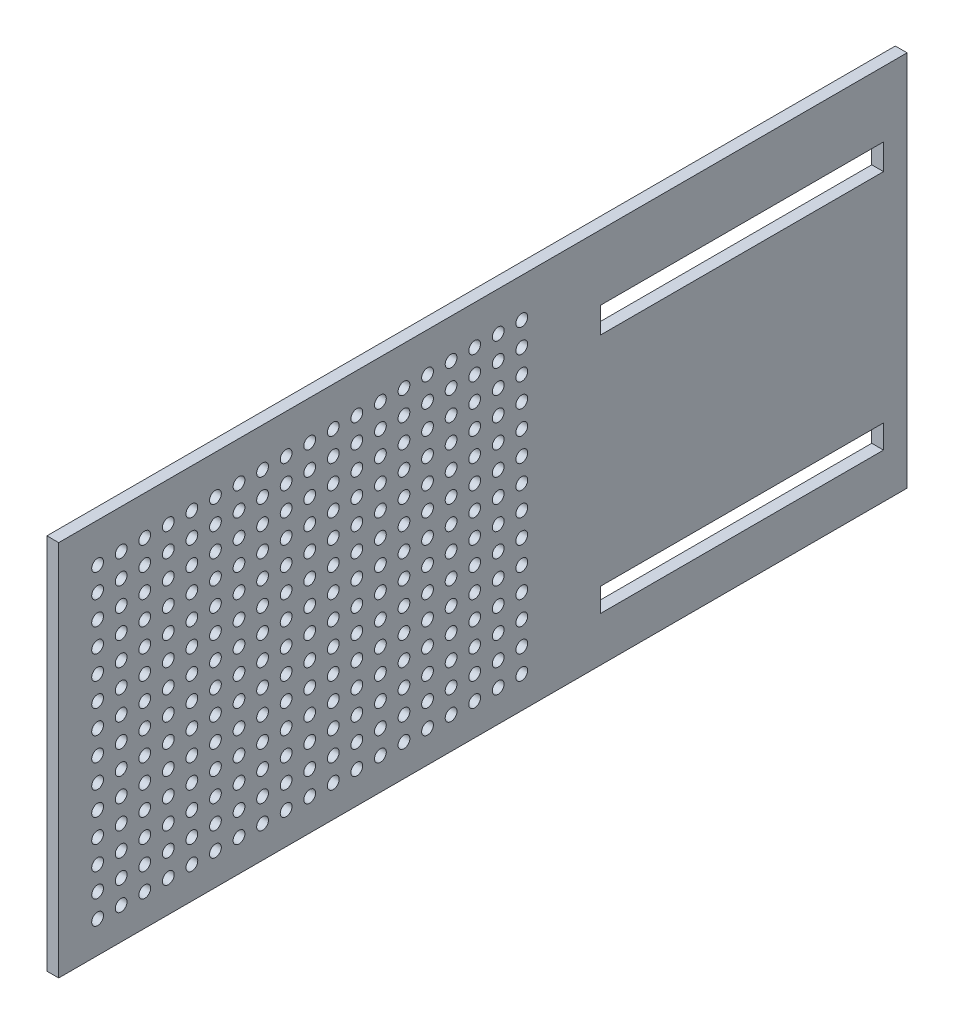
SolidWorks part; units mm, degrees
ref_plane "Front Plane" through (0, 0, 0) normal (0, 0, 1) x (1, 0, 0)
ref_plane "Top Plane" through (0, 0, 0) normal (0, 1, 0) x (1, 0, 0)
ref_plane "Right Plane" through (0, 0, 0) normal (1, 0, 0) x (0, 0, -1)
sketch "Sketch1" plane through (0, 0, 0) normal (0, 0, 1) x (1, 0, 0)
  line L0 (1.5875, 47.625) -> (36.5125, 47.625)
  line L1 (1.5875, -50.8) -> (-1.5875, -50.8)
  line L2 (1.5875, -50.8) -> (1.5875, 47.625)
  line L4 (-1.5875, -50.8) -> (-1.5875, 50.8)
  line L5 (1.5875, -50.8) -> (-1.5875, 50.8) construction
  line L6 (3.5127, 112.4075) -> (-1.5875, -50.8) construction
  line L7 (-1.5875, 50.8) -> (36.5125, 50.8)
  line L10 (36.5125, 50.8) -> (36.5125, 47.625)
  point P0 (0, 0)
  point P7 (0, -50.8)
extrude "Boss-Extrude1" add sketch "Sketch1" along normal blind 228.6
sketch "Sketch2" plane through (1.5875, 0, 0) normal (1, 0, 0) x (0, 0, -1)
  line L0 (-228.6, -29.4596) -> (0, 47.625) construction
  line L1 (-228.6, -50.8) -> (-228.6, 47.625) construction
  line L2 (-228.6, 47.625) -> (0, 47.625) construction
  line L3 (0, -50.8) -> (0, 47.625) construction
ref_plane "Plane1 - BACKBOARD PLANE" through (0, 42.7626, 14.4197) normal (0, -0.9476, -0.3195) x (0, 0.3195, -0.9476)
ref_plane "Plane1" through (0, -1.5875, 0) normal (0, -1, 0) x (-1, 0, 0)
sketch "Sketch3" plane through (-1.5875, 0, 0) normal (-1, 0, 0) x (0, 0, 1)
  line L0 (228.6, -50.8) -> (0, -50.8) construction
  line L1 (82.55, -32.385) -> (6.35, -32.385)
  line L2 (82.55, -32.385) -> (82.55, -38.735)
  line L3 (82.55, -38.735) -> (6.35, -38.735)
  line L4 (6.35, -32.385) -> (6.35, -38.735)
  line L5 (82.55, -32.385) -> (6.35, -38.735) construction
  line L6 (82.55, -38.735) -> (6.35, -32.385) construction
  line L7 (0, 50.8) -> (0, -50.8) construction
  line L18 (6.35, 33.1888) -> (82.55, 33.1888)
  line L19 (6.35, 33.1888) -> (6.35, 26.2472)
  line L20 (6.35, 26.2472) -> (82.55, 26.2472)
  line L21 (82.55, 33.1888) -> (82.55, 26.2472)
  point P0 (44.45, -35.56)
  point P13 (6.35, 29.718)
  point P14 (6.35, -35.56)
  dimension "D1" = 6.35
  dimension "D2" = 15.24
  dimension "D3" = 76.2
  dimension "D4" = 6.35
  dimension "D5" = 65.278
extrude "Cut-Extrude1" cut sketch "Sketch3" against normal up to next
sketch "Sketch4" plane through (-1.5875, 0, 0) normal (-1, 0, 0) x (0, 0, 1)
  circle A0 centre (103.8185, 40.3289) radius 1.5875
  circle A1 centre (110.1685, 40.3289) radius 1.5875
  circle A2 centre (116.5185, 40.3289) radius 1.5875
  circle A3 centre (122.8685, 40.3289) radius 1.5875
  circle A4 centre (129.2185, 40.3289) radius 1.5875
  circle A5 centre (110.1685, 33.9789) radius 1.5875
  circle A6 centre (116.5185, 33.9789) radius 1.5875
  circle A7 centre (122.8685, 33.9789) radius 1.5875
  circle A8 centre (129.2185, 33.9789) radius 1.5875
  circle A9 centre (110.1685, 27.6289) radius 1.5875
  circle A10 centre (116.5185, 27.6289) radius 1.5875
  circle A11 centre (122.8685, 27.6289) radius 1.5875
  circle A12 centre (129.2185, 27.6289) radius 1.5875
  circle A13 centre (110.1685, 21.2789) radius 1.5875
  circle A14 centre (116.5185, 21.2789) radius 1.5875
  circle A15 centre (122.8685, 21.2789) radius 1.5875
  circle A16 centre (129.2185, 21.2789) radius 1.5875
  circle A17 centre (103.8185, 33.9789) radius 1.5875
  circle A18 centre (103.8185, 27.6289) radius 1.5875
  circle A19 centre (103.8185, 21.2789) radius 1.5875
  circle A20 centre (135.5685, 40.3289) radius 1.5875
  circle A21 centre (141.9185, 40.3289) radius 1.5875
  circle A22 centre (148.2685, 40.3289) radius 1.5875
  circle A23 centre (154.6185, 40.3289) radius 1.5875
  circle A24 centre (160.9685, 40.3289) radius 1.5875
  circle A25 centre (167.3185, 40.3289) radius 1.5875
  circle A26 centre (173.6685, 40.3289) radius 1.5875
  circle A27 centre (180.0185, 40.3289) radius 1.5875
  circle A28 centre (186.3685, 40.3289) radius 1.5875
  circle A29 centre (192.7185, 40.3289) radius 1.5875
  circle A30 centre (199.0685, 40.3289) radius 1.5875
  circle A31 centre (205.4185, 40.3289) radius 1.5875
  circle A32 centre (211.7685, 40.3289) radius 1.5875
  circle A33 centre (218.1185, 40.3289) radius 1.5875
  circle A34 centre (135.5685, 33.9789) radius 1.5875
  circle A35 centre (141.9185, 33.9789) radius 1.5875
  circle A36 centre (148.2685, 33.9789) radius 1.5875
  circle A37 centre (154.6185, 33.9789) radius 1.5875
  circle A38 centre (160.9685, 33.9789) radius 1.5875
  circle A39 centre (167.3185, 33.9789) radius 1.5875
  circle A40 centre (173.6685, 33.9789) radius 1.5875
  circle A41 centre (180.0185, 33.9789) radius 1.5875
  circle A42 centre (186.3685, 33.9789) radius 1.5875
  circle A43 centre (192.7185, 33.9789) radius 1.5875
  circle A44 centre (199.0685, 33.9789) radius 1.5875
  circle A45 centre (205.4185, 33.9789) radius 1.5875
  circle A46 centre (211.7685, 33.9789) radius 1.5875
  circle A47 centre (218.1185, 33.9789) radius 1.5875
  circle A48 centre (135.5685, 27.6289) radius 1.5875
  circle A49 centre (141.9185, 27.6289) radius 1.5875
  circle A50 centre (148.2685, 27.6289) radius 1.5875
  circle A51 centre (154.6185, 27.6289) radius 1.5875
  circle A52 centre (160.9685, 27.6289) radius 1.5875
  circle A53 centre (167.3185, 27.6289) radius 1.5875
  circle A54 centre (173.6685, 27.6289) radius 1.5875
  circle A55 centre (180.0185, 27.6289) radius 1.5875
  circle A56 centre (186.3685, 27.6289) radius 1.5875
  circle A57 centre (192.7185, 27.6289) radius 1.5875
  circle A58 centre (199.0685, 27.6289) radius 1.5875
  circle A59 centre (205.4185, 27.6289) radius 1.5875
  circle A60 centre (211.7685, 27.6289) radius 1.5875
  circle A61 centre (218.1185, 27.6289) radius 1.5875
  circle A62 centre (135.5685, 21.2789) radius 1.5875
  circle A63 centre (141.9185, 21.2789) radius 1.5875
  circle A64 centre (148.2685, 21.2789) radius 1.5875
  circle A65 centre (154.6185, 21.2789) radius 1.5875
  circle A66 centre (160.9685, 21.2789) radius 1.5875
  circle A67 centre (167.3185, 21.2789) radius 1.5875
  circle A68 centre (173.6685, 21.2789) radius 1.5875
  circle A69 centre (180.0185, 21.2789) radius 1.5875
  circle A70 centre (186.3685, 21.2789) radius 1.5875
  circle A71 centre (192.7185, 21.2789) radius 1.5875
  circle A72 centre (199.0685, 21.2789) radius 1.5875
  circle A73 centre (205.4185, 21.2789) radius 1.5875
  circle A74 centre (211.7685, 21.2789) radius 1.5875
  circle A75 centre (218.1185, 21.2789) radius 1.5875
  circle A76 centre (103.8185, 14.9289) radius 1.5875
  circle A77 centre (110.1685, 14.9289) radius 1.5875
  circle A78 centre (116.5185, 14.9289) radius 1.5875
  circle A79 centre (122.8685, 14.9289) radius 1.5875
  circle A80 centre (129.2185, 14.9289) radius 1.5875
  circle A81 centre (135.5685, 14.9289) radius 1.5875
  circle A82 centre (141.9185, 14.9289) radius 1.5875
  circle A83 centre (148.2685, 14.9289) radius 1.5875
  circle A84 centre (154.6185, 14.9289) radius 1.5875
  circle A85 centre (160.9685, 14.9289) radius 1.5875
  circle A86 centre (167.3185, 14.9289) radius 1.5875
  circle A87 centre (173.6685, 14.9289) radius 1.5875
  circle A88 centre (180.0185, 14.9289) radius 1.5875
  circle A89 centre (186.3685, 14.9289) radius 1.5875
  circle A90 centre (192.7185, 14.9289) radius 1.5875
  circle A91 centre (199.0685, 14.9289) radius 1.5875
  circle A92 centre (205.4185, 14.9289) radius 1.5875
  circle A93 centre (211.7685, 14.9289) radius 1.5875
  circle A94 centre (218.1185, 14.9289) radius 1.5875
  circle A95 centre (103.8185, 8.5789) radius 1.5875
  circle A96 centre (110.1685, 8.5789) radius 1.5875
  circle A97 centre (116.5185, 8.5789) radius 1.5875
  circle A98 centre (122.8685, 8.5789) radius 1.5875
  circle A99 centre (129.2185, 8.5789) radius 1.5875
  circle A100 centre (135.5685, 8.5789) radius 1.5875
  circle A101 centre (141.9185, 8.5789) radius 1.5875
  circle A102 centre (148.2685, 8.5789) radius 1.5875
  circle A103 centre (154.6185, 8.5789) radius 1.5875
  circle A104 centre (160.9685, 8.5789) radius 1.5875
  circle A105 centre (167.3185, 8.5789) radius 1.5875
  circle A106 centre (173.6685, 8.5789) radius 1.5875
  circle A107 centre (180.0185, 8.5789) radius 1.5875
  circle A108 centre (186.3685, 8.5789) radius 1.5875
  circle A109 centre (192.7185, 8.5789) radius 1.5875
  circle A110 centre (199.0685, 8.5789) radius 1.5875
  circle A111 centre (205.4185, 8.5789) radius 1.5875
  circle A112 centre (211.7685, 8.5789) radius 1.5875
  circle A113 centre (218.1185, 8.5789) radius 1.5875
  circle A114 centre (103.8185, 2.2289) radius 1.5875
  circle A115 centre (110.1685, 2.2289) radius 1.5875
  circle A116 centre (116.5185, 2.2289) radius 1.5875
  circle A117 centre (122.8685, 2.2289) radius 1.5875
  circle A118 centre (129.2185, 2.2289) radius 1.5875
  circle A119 centre (135.5685, 2.2289) radius 1.5875
  circle A120 centre (141.9185, 2.2289) radius 1.5875
  circle A121 centre (148.2685, 2.2289) radius 1.5875
  circle A122 centre (154.6185, 2.2289) radius 1.5875
  circle A123 centre (160.9685, 2.2289) radius 1.5875
  circle A124 centre (167.3185, 2.2289) radius 1.5875
  circle A125 centre (173.6685, 2.2289) radius 1.5875
  circle A126 centre (180.0185, 2.2289) radius 1.5875
  circle A127 centre (186.3685, 2.2289) radius 1.5875
  circle A128 centre (192.7185, 2.2289) radius 1.5875
  circle A129 centre (199.0685, 2.2289) radius 1.5875
  circle A130 centre (205.4185, 2.2289) radius 1.5875
  circle A131 centre (211.7685, 2.2289) radius 1.5875
  circle A132 centre (218.1185, 2.2289) radius 1.5875
  circle A133 centre (103.8185, -4.1211) radius 1.5875
  circle A134 centre (110.1685, -4.1211) radius 1.5875
  circle A135 centre (116.5185, -4.1211) radius 1.5875
  circle A136 centre (122.8685, -4.1211) radius 1.5875
  circle A137 centre (129.2185, -4.1211) radius 1.5875
  circle A138 centre (135.5685, -4.1211) radius 1.5875
  circle A139 centre (141.9185, -4.1211) radius 1.5875
  circle A140 centre (148.2685, -4.1211) radius 1.5875
  circle A141 centre (154.6185, -4.1211) radius 1.5875
  circle A142 centre (160.9685, -4.1211) radius 1.5875
  circle A143 centre (167.3185, -4.1211) radius 1.5875
  circle A144 centre (173.6685, -4.1211) radius 1.5875
  circle A145 centre (180.0185, -4.1211) radius 1.5875
  circle A146 centre (186.3685, -4.1211) radius 1.5875
  circle A147 centre (192.7185, -4.1211) radius 1.5875
  circle A148 centre (199.0685, -4.1211) radius 1.5875
  circle A149 centre (205.4185, -4.1211) radius 1.5875
  circle A150 centre (211.7685, -4.1211) radius 1.5875
  circle A151 centre (218.1185, -4.1211) radius 1.5875
  circle A152 centre (103.8185, -10.4711) radius 1.5875
  circle A153 centre (110.1685, -10.4711) radius 1.5875
  circle A154 centre (116.5185, -10.4711) radius 1.5875
  circle A155 centre (122.8685, -10.4711) radius 1.5875
  circle A156 centre (129.2185, -10.4711) radius 1.5875
  circle A157 centre (135.5685, -10.4711) radius 1.5875
  circle A158 centre (141.9185, -10.4711) radius 1.5875
  circle A159 centre (148.2685, -10.4711) radius 1.5875
  circle A160 centre (154.6185, -10.4711) radius 1.5875
  circle A161 centre (160.9685, -10.4711) radius 1.5875
  circle A162 centre (167.3185, -10.4711) radius 1.5875
  circle A163 centre (173.6685, -10.4711) radius 1.5875
  circle A164 centre (180.0185, -10.4711) radius 1.5875
  circle A165 centre (186.3685, -10.4711) radius 1.5875
  circle A166 centre (192.7185, -10.4711) radius 1.5875
  circle A167 centre (199.0685, -10.4711) radius 1.5875
  circle A168 centre (205.4185, -10.4711) radius 1.5875
  circle A169 centre (211.7685, -10.4711) radius 1.5875
  circle A170 centre (218.1185, -10.4711) radius 1.5875
  circle A171 centre (103.8185, -16.8211) radius 1.5875
  circle A172 centre (110.1685, -16.8211) radius 1.5875
  circle A173 centre (116.5185, -16.8211) radius 1.5875
  circle A174 centre (122.8685, -16.8211) radius 1.5875
  circle A175 centre (129.2185, -16.8211) radius 1.5875
  circle A176 centre (135.5685, -16.8211) radius 1.5875
  circle A177 centre (141.9185, -16.8211) radius 1.5875
  circle A178 centre (148.2685, -16.8211) radius 1.5875
  circle A179 centre (154.6185, -16.8211) radius 1.5875
  circle A180 centre (160.9685, -16.8211) radius 1.5875
  circle A181 centre (167.3185, -16.8211) radius 1.5875
  circle A182 centre (173.6685, -16.8211) radius 1.5875
  circle A183 centre (180.0185, -16.8211) radius 1.5875
  circle A184 centre (186.3685, -16.8211) radius 1.5875
  circle A185 centre (192.7185, -16.8211) radius 1.5875
  circle A186 centre (199.0685, -16.8211) radius 1.5875
  circle A187 centre (205.4185, -16.8211) radius 1.5875
  circle A188 centre (211.7685, -16.8211) radius 1.5875
  circle A189 centre (218.1185, -16.8211) radius 1.5875
  circle A190 centre (103.8185, -23.1711) radius 1.5875
  circle A191 centre (110.1685, -23.1711) radius 1.5875
  circle A192 centre (116.5185, -23.1711) radius 1.5875
  circle A193 centre (122.8685, -23.1711) radius 1.5875
  circle A194 centre (129.2185, -23.1711) radius 1.5875
  circle A195 centre (135.5685, -23.1711) radius 1.5875
  circle A196 centre (141.9185, -23.1711) radius 1.5875
  circle A197 centre (148.2685, -23.1711) radius 1.5875
  circle A198 centre (154.6185, -23.1711) radius 1.5875
  circle A199 centre (160.9685, -23.1711) radius 1.5875
  circle A200 centre (167.3185, -23.1711) radius 1.5875
  circle A201 centre (173.6685, -23.1711) radius 1.5875
  circle A202 centre (180.0185, -23.1711) radius 1.5875
  circle A203 centre (186.3685, -23.1711) radius 1.5875
  circle A204 centre (192.7185, -23.1711) radius 1.5875
  circle A205 centre (199.0685, -23.1711) radius 1.5875
  circle A206 centre (205.4185, -23.1711) radius 1.5875
  circle A207 centre (211.7685, -23.1711) radius 1.5875
  circle A208 centre (218.1185, -23.1711) radius 1.5875
  circle A209 centre (103.8185, -29.5211) radius 1.5875
  circle A210 centre (110.1685, -29.5211) radius 1.5875
  circle A211 centre (116.5185, -29.5211) radius 1.5875
  circle A212 centre (122.8685, -29.5211) radius 1.5875
  circle A213 centre (129.2185, -29.5211) radius 1.5875
  circle A214 centre (135.5685, -29.5211) radius 1.5875
  circle A215 centre (141.9185, -29.5211) radius 1.5875
  circle A216 centre (148.2685, -29.5211) radius 1.5875
  circle A217 centre (154.6185, -29.5211) radius 1.5875
  circle A218 centre (160.9685, -29.5211) radius 1.5875
  circle A219 centre (167.3185, -29.5211) radius 1.5875
  circle A220 centre (173.6685, -29.5211) radius 1.5875
  circle A221 centre (180.0185, -29.5211) radius 1.5875
  circle A222 centre (186.3685, -29.5211) radius 1.5875
  circle A223 centre (192.7185, -29.5211) radius 1.5875
  circle A224 centre (199.0685, -29.5211) radius 1.5875
  circle A225 centre (205.4185, -29.5211) radius 1.5875
  circle A226 centre (211.7685, -29.5211) radius 1.5875
  circle A227 centre (218.1185, -29.5211) radius 1.5875
  circle A228 centre (103.8185, -35.8711) radius 1.5875
  circle A229 centre (110.1685, -35.8711) radius 1.5875
  circle A230 centre (116.5185, -35.8711) radius 1.5875
  circle A231 centre (122.8685, -35.8711) radius 1.5875
  circle A232 centre (129.2185, -35.8711) radius 1.5875
  circle A233 centre (135.5685, -35.8711) radius 1.5875
  circle A234 centre (141.9185, -35.8711) radius 1.5875
  circle A235 centre (148.2685, -35.8711) radius 1.5875
  circle A236 centre (154.6185, -35.8711) radius 1.5875
  circle A237 centre (160.9685, -35.8711) radius 1.5875
  circle A238 centre (167.3185, -35.8711) radius 1.5875
  circle A239 centre (173.6685, -35.8711) radius 1.5875
  circle A240 centre (180.0185, -35.8711) radius 1.5875
  circle A241 centre (186.3685, -35.8711) radius 1.5875
  circle A242 centre (192.7185, -35.8711) radius 1.5875
  circle A243 centre (199.0685, -35.8711) radius 1.5875
  circle A244 centre (205.4185, -35.8711) radius 1.5875
  circle A245 centre (211.7685, -35.8711) radius 1.5875
  circle A246 centre (218.1185, -35.8711) radius 1.5875
  circle A247 centre (103.8185, -42.2211) radius 1.5875
  circle A248 centre (110.1685, -42.2211) radius 1.5875
  circle A249 centre (116.5185, -42.2211) radius 1.5875
  circle A250 centre (122.8685, -42.2211) radius 1.5875
  circle A251 centre (129.2185, -42.2211) radius 1.5875
  circle A252 centre (135.5685, -42.2211) radius 1.5875
  circle A253 centre (141.9185, -42.2211) radius 1.5875
  circle A254 centre (148.2685, -42.2211) radius 1.5875
  circle A255 centre (154.6185, -42.2211) radius 1.5875
  circle A256 centre (160.9685, -42.2211) radius 1.5875
  circle A257 centre (167.3185, -42.2211) radius 1.5875
  circle A258 centre (173.6685, -42.2211) radius 1.5875
  circle A259 centre (180.0185, -42.2211) radius 1.5875
  circle A260 centre (186.3685, -42.2211) radius 1.5875
  circle A261 centre (192.7185, -42.2211) radius 1.5875
  circle A262 centre (199.0685, -42.2211) radius 1.5875
  circle A263 centre (205.4185, -42.2211) radius 1.5875
  circle A264 centre (211.7685, -42.2211) radius 1.5875
  circle A265 centre (218.1185, -42.2211) radius 1.5875
  dimension "D1" = 3.175
  dimension "D2" = 19
  dimension "D3" = 14
extrude "Cut-Extrude2" cut sketch "Sketch4" against normal up to next (3.175 mm away)
sketch "Sketch5" plane through (0, 50.8, 0) normal (0, 1, 0) x (1, 0, 0)
  line L0 (36.5125, 0) -> (-1.5875, 0) construction
  line L1 (18.7325, -5.08) -> (12.1285, -5.08)
  line L2 (18.7325, -5.08) -> (18.7325, -157.48)
  line L3 (18.7325, -157.48) -> (12.1285, -157.48)
  line L4 (12.1285, -5.08) -> (12.1285, -157.48)
  line L5 (36.5125, -228.6) -> (36.5125, 0) construction
  point P8 (15.4305, -5.08)
  dimension "D1" = 6.604
  dimension "D2" = 152.4
  dimension "D3" = 5.08
  dimension "D4" = 21.082
extrude "Cut-Extrude3" cut sketch "Sketch5" against normal up to next
sketch "Sketch6" plane through (0, 50.8, 0) normal (0, 1, 0) x (1, 0, 0)
  line L0 (36.5125, -228.6) -> (-1.5875, -228.6) construction
  line L1 (36.5125, -228.6) -> (36.5125, 0) construction
  circle A0 centre (6.0325, -222.25) radius 1.5875
  circle A1 centre (12.3825, -222.25) radius 1.5875
  circle A2 centre (18.7325, -222.25) radius 1.5875
  circle A3 centre (25.0825, -222.25) radius 1.5875
  circle A4 centre (31.4325, -222.25) radius 1.5875
  circle A5 centre (12.3825, -215.9) radius 1.5875
  circle A6 centre (18.7325, -215.9) radius 1.5875
  circle A7 centre (25.0825, -215.9) radius 1.5875
  circle A8 centre (31.4325, -215.9) radius 1.5875
  circle A9 centre (12.3825, -209.55) radius 1.5875
  circle A10 centre (18.7325, -209.55) radius 1.5875
  circle A11 centre (25.0825, -209.55) radius 1.5875
  circle A12 centre (31.4325, -209.55) radius 1.5875
  circle A13 centre (12.3825, -203.2) radius 1.5875
  circle A14 centre (18.7325, -203.2) radius 1.5875
  circle A15 centre (25.0825, -203.2) radius 1.5875
  circle A16 centre (31.4325, -203.2) radius 1.5875
  circle A17 centre (12.3825, -196.85) radius 1.5875
  circle A18 centre (18.7325, -196.85) radius 1.5875
  circle A19 centre (25.0825, -196.85) radius 1.5875
  circle A20 centre (31.4325, -196.85) radius 1.5875
  circle A21 centre (12.3825, -190.5) radius 1.5875
  circle A22 centre (18.7325, -190.5) radius 1.5875
  circle A23 centre (25.0825, -190.5) radius 1.5875
  circle A24 centre (31.4325, -190.5) radius 1.5875
  circle A25 centre (12.3825, -184.15) radius 1.5875
  circle A26 centre (18.7325, -184.15) radius 1.5875
  circle A27 centre (25.0825, -184.15) radius 1.5875
  circle A28 centre (31.4325, -184.15) radius 1.5875
  circle A29 centre (12.3825, -177.8) radius 1.5875
  circle A30 centre (18.7325, -177.8) radius 1.5875
  circle A31 centre (25.0825, -177.8) radius 1.5875
  circle A32 centre (31.4325, -177.8) radius 1.5875
  circle A33 centre (12.3825, -171.45) radius 1.5875
  circle A34 centre (18.7325, -171.45) radius 1.5875
  circle A35 centre (25.0825, -171.45) radius 1.5875
  circle A36 centre (31.4325, -171.45) radius 1.5875
  circle A37 centre (12.3825, -165.1) radius 1.5875
  circle A38 centre (18.7325, -165.1) radius 1.5875
  circle A39 centre (25.0825, -165.1) radius 1.5875
  circle A40 centre (31.4325, -165.1) radius 1.5875
  circle A43 centre (25.0825, -158.75) radius 1.5875
  circle A44 centre (31.4325, -158.75) radius 1.5875
  circle A47 centre (25.0825, -152.4) radius 1.5875
  circle A48 centre (31.4325, -152.4) radius 1.5875
  circle A51 centre (25.0825, -146.05) radius 1.5875
  circle A52 centre (31.4325, -146.05) radius 1.5875
  circle A55 centre (25.0825, -139.7) radius 1.5875
  circle A56 centre (31.4325, -139.7) radius 1.5875
  circle A59 centre (25.0825, -133.35) radius 1.5875
  circle A60 centre (31.4325, -133.35) radius 1.5875
  circle A63 centre (25.0825, -127) radius 1.5875
  circle A64 centre (31.4325, -127) radius 1.5875
  circle A67 centre (25.0825, -120.65) radius 1.5875
  circle A68 centre (31.4325, -120.65) radius 1.5875
  circle A71 centre (25.0825, -114.3) radius 1.5875
  circle A72 centre (31.4325, -114.3) radius 1.5875
  circle A75 centre (25.0825, -107.95) radius 1.5875
  circle A76 centre (31.4325, -107.95) radius 1.5875
  circle A79 centre (25.0825, -101.6) radius 1.5875
  circle A80 centre (31.4325, -101.6) radius 1.5875
  circle A83 centre (25.0825, -95.25) radius 1.5875
  circle A84 centre (31.4325, -95.25) radius 1.5875
  circle A87 centre (25.0825, -88.9) radius 1.5875
  circle A88 centre (31.4325, -88.9) radius 1.5875
  circle A91 centre (25.0825, -82.55) radius 1.5875
  circle A92 centre (31.4325, -82.55) radius 1.5875
  circle A95 centre (25.0825, -76.2) radius 1.5875
  circle A96 centre (31.4325, -76.2) radius 1.5875
  circle A99 centre (25.0825, -69.85) radius 1.5875
  circle A100 centre (31.4325, -69.85) radius 1.5875
  circle A103 centre (25.0825, -63.5) radius 1.5875
  circle A104 centre (31.4325, -63.5) radius 1.5875
  circle A107 centre (25.0825, -57.15) radius 1.5875
  circle A108 centre (31.4325, -57.15) radius 1.5875
  circle A111 centre (25.0825, -50.8) radius 1.5875
  circle A112 centre (31.4325, -50.8) radius 1.5875
  circle A115 centre (25.0825, -44.45) radius 1.5875
  circle A116 centre (31.4325, -44.45) radius 1.5875
  circle A119 centre (25.0825, -38.1) radius 1.5875
  circle A120 centre (31.4325, -38.1) radius 1.5875
  circle A121 centre (6.0325, -215.9) radius 1.5875
  circle A122 centre (6.0325, -209.55) radius 1.5875
  circle A123 centre (6.0325, -203.2) radius 1.5875
  circle A124 centre (6.0325, -196.85) radius 1.5875
  circle A125 centre (6.0325, -190.5) radius 1.5875
  circle A126 centre (6.0325, -184.15) radius 1.5875
  circle A127 centre (6.0325, -177.8) radius 1.5875
  circle A128 centre (6.0325, -171.45) radius 1.5875
  circle A129 centre (6.0325, -165.1) radius 1.5875
  circle A130 centre (6.0325, -158.75) radius 1.5875
  circle A131 centre (6.0325, -152.4) radius 1.5875
  circle A132 centre (6.0325, -146.05) radius 1.5875
  circle A133 centre (6.0325, -139.7) radius 1.5875
  circle A134 centre (6.0325, -133.35) radius 1.5875
  circle A135 centre (6.0325, -127) radius 1.5875
  circle A136 centre (6.0325, -120.65) radius 1.5875
  circle A137 centre (6.0325, -114.3) radius 1.5875
  circle A138 centre (6.0325, -107.95) radius 1.5875
  circle A139 centre (6.0325, -101.6) radius 1.5875
  circle A140 centre (6.0325, -95.25) radius 1.5875
  circle A141 centre (6.0325, -88.9) radius 1.5875
  circle A142 centre (6.0325, -82.55) radius 1.5875
  circle A143 centre (6.0325, -76.2) radius 1.5875
  circle A144 centre (6.0325, -69.85) radius 1.5875
  circle A145 centre (6.0325, -63.5) radius 1.5875
  circle A146 centre (6.0325, -57.15) radius 1.5875
  circle A147 centre (6.0325, -50.8) radius 1.5875
  circle A148 centre (6.0325, -44.45) radius 1.5875
  circle A149 centre (6.0325, -38.1) radius 1.5875
  circle A150 centre (18.7325, -50.8) radius 1.5875
  circle A151 centre (12.3825, -44.45) radius 1.5875
  circle A152 centre (18.7325, -44.45) radius 1.5875
  circle A153 centre (12.3825, -38.1) radius 1.5875
  circle A154 centre (18.7325, -38.1) radius 1.5875
  circle A155 centre (12.3825, -63.5) radius 1.5875
  circle A156 centre (18.7325, -63.5) radius 1.5875
  circle A157 centre (12.3825, -57.15) radius 1.5875
  circle A158 centre (18.7325, -57.15) radius 1.5875
  circle A159 centre (12.3825, -50.8) radius 1.5875
  circle A160 centre (12.3825, -158.75) radius 1.5875
  circle A161 centre (18.7325, -158.75) radius 1.5875
  circle A162 centre (12.3825, -152.4) radius 1.5875
  circle A163 centre (18.7325, -152.4) radius 1.5875
  circle A164 centre (12.3825, -146.05) radius 1.5875
  circle A165 centre (18.7325, -146.05) radius 1.5875
  circle A166 centre (12.3825, -139.7) radius 1.5875
  circle A167 centre (18.7325, -139.7) radius 1.5875
  circle A168 centre (12.3825, -133.35) radius 1.5875
  circle A169 centre (18.7325, -133.35) radius 1.5875
  circle A170 centre (12.3825, -127) radius 1.5875
  circle A171 centre (18.7325, -127) radius 1.5875
  circle A172 centre (12.3825, -120.65) radius 1.5875
  circle A173 centre (18.7325, -120.65) radius 1.5875
  circle A174 centre (12.3825, -114.3) radius 1.5875
  circle A175 centre (18.7325, -114.3) radius 1.5875
  circle A176 centre (12.3825, -107.95) radius 1.5875
  circle A177 centre (18.7325, -107.95) radius 1.5875
  circle A178 centre (12.3825, -101.6) radius 1.5875
  circle A179 centre (18.7325, -101.6) radius 1.5875
  circle A180 centre (12.3825, -95.25) radius 1.5875
  circle A181 centre (18.7325, -95.25) radius 1.5875
  circle A182 centre (12.3825, -88.9) radius 1.5875
  circle A183 centre (18.7325, -88.9) radius 1.5875
  circle A184 centre (12.3825, -82.55) radius 1.5875
  circle A185 centre (18.7325, -82.55) radius 1.5875
  circle A186 centre (12.3825, -76.2) radius 1.5875
  circle A187 centre (18.7325, -76.2) radius 1.5875
  circle A188 centre (12.3825, -69.85) radius 1.5875
  circle A189 centre (18.7325, -69.85) radius 1.5875
  dimension "D1" = 3.175
  dimension "D2" = 6.35
  dimension "D3" = 30.48
  dimension "D4" = 5
  dimension "D5" = 30
extrude "Cut-Extrude4" cut sketch "Sketch6" against normal up to next (3.175 mm away)
ref_plane "Plane2" through (1.5875, 0, 0) normal (1, 0, 0) x (0, 0, -1)
sketch "Sketch7" plane through (0, 0, 228.6) normal (0, 0, 1) x (1, 0, 0)
  line L0 (36.5125, 50.8) -> (-1.5875, 50.8) construction
  line L1 (1.5875, 50.8) -> (36.5125, 50.8)
  line L2 (1.5875, 50.8) -> (1.5875, 47.625)
  line L3 (1.5875, 47.625) -> (36.5125, 47.625)
  line L4 (36.5125, 50.8) -> (36.5125, 47.625)
  line L5 (1.5875, -54.1337) -> (1.5875, 54.1337) construction
  line L6 (36.5125, 47.625) -> (36.5125, 50.8) construction
  line L7 (1.5875, 47.625) -> (36.5125, 47.625) construction
extrude "Cut-Extrude5" cut sketch "Sketch7" against normal through all
equation "\"eighthinch\"= 0.125"
equation "\"D2@Sketch1\"=\"eighthinch\""
